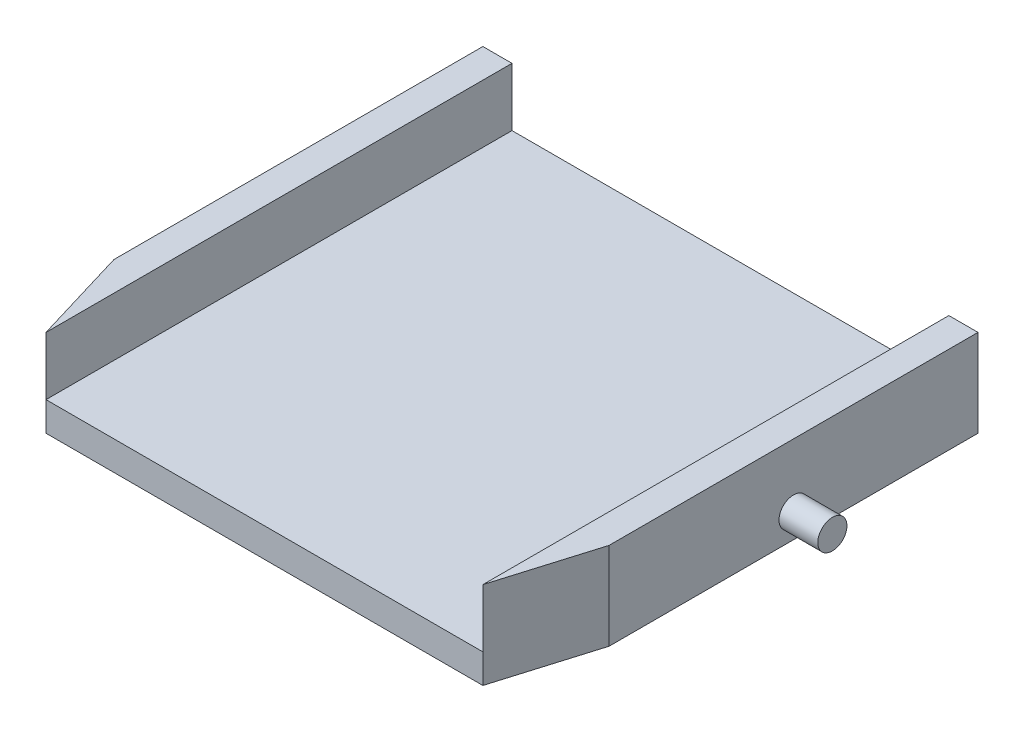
SolidWorks part; units mm, degrees
ref_plane "Front Plane" through (0, 0, 0) normal (0, 0, 1) x (1, 0, 0)
ref_plane "Top Plane" through (0, 0, 0) normal (0, 1, 0) x (1, 0, 0)
ref_plane "Right Plane" through (0, 0, 0) normal (1, 0, 0) x (0, 0, -1)
sketch "Sketch1" plane through (0, 0, 0) normal (0, 1, 0) x (1, 0, 0)
  line L0 (45, 0) -> (48, 10)
  line L1 (0, 0) -> (45, 0)
  line L2 (0, 0) -> (0, 48) construction
  line L3 (0, 48) -> (45, 48)
  line L4 (45, 0) -> (45, 48) construction
  line L5 (48, 10) -> (48, 48)
  line L6 (48, 48) -> (45, 48)
  line L7 (22.5, 48) -> (22.5, 0) construction
  line L8 (0, 0) -> (-3, 10)
  line L9 (-3, 48) -> (0, 48)
  line L10 (-3, 10) -> (-3, 48)
  dimension "D1" = 45
  dimension "D2" = 48
  dimension "D3" = 3
  dimension "D4" = 38
extrude "Boss-Extrude2" add sketch "Sketch1" along normal blind 3
sketch "Sketch2" plane through (0, 3, 0) normal (0, 1, 0) x (1, 0, 0)
  line L0 (0, 0) -> (0, 48)
  line L1 (48, 48) -> (-3, 48) construction
  line L2 (0, 48) -> (-3, 48)
  line L3 (-3, 48) -> (-3, 10)
  line L4 (-3, 10) -> (0, 0)
  line L5 (45, 0) -> (48, 10)
  line L6 (48, 10) -> (48, 48)
  line L7 (48, 48) -> (45, 48)
  line L8 (45, 48) -> (45, 0)
extrude "Boss-Extrude3" add sketch "Sketch2" along normal blind 6
sketch "Sketch3" plane through (48, 0, 0) normal (1, 0, 0) x (0, 0, -1)
  line L0 (29, 0) -> (29, 9) construction
  line L1 (10, 0) -> (48, 0) construction
  line L2 (10, 9) -> (48, 9) construction
  circle A0 centre (29, 2.5) radius 1.5
  dimension "D1" = 3
  dimension "D2" = 2.5
extrude "Boss-Extrude4" add sketch "Sketch3" along normal blind 4
sketch "Sketch4" plane through (-3, 0, 0) normal (-1, 0, 0) x (0, 0, 1)
  line L0 (-29, 9) -> (-29, 0) construction
  line L1 (-48, 9) -> (-10, 9) construction
  line L2 (-48, 0) -> (-10, 0) construction
  circle A0 centre (-29, 2.5) radius 1.5
  dimension "D2" = 3
  dimension "D1" = 2.5
extrude "Boss-Extrude5" add sketch "Sketch4" along normal blind 4
